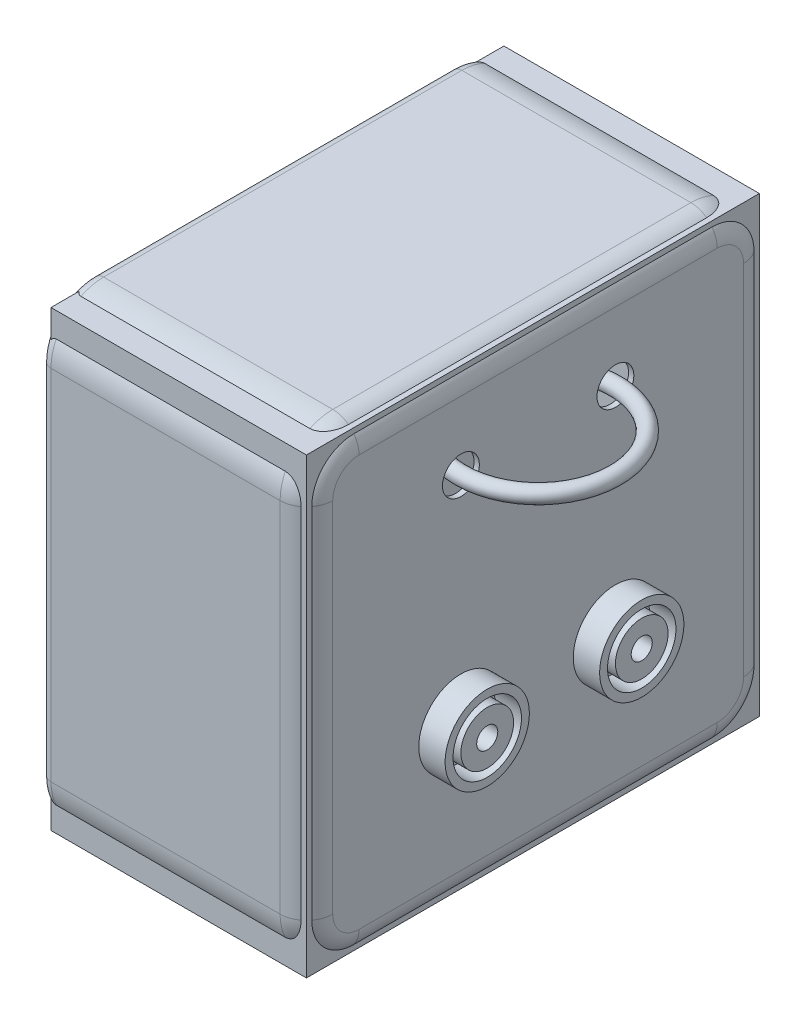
SolidWorks part; units mm, degrees
ref_plane "Plan de face" through (0, 0, 0) normal (0, 0, 1) x (1, 0, 0)
ref_plane "Plan de dessus" through (0, 0, 0) normal (0, 1, 0) x (1, 0, 0)
ref_plane "Plan de droite" through (0, 0, 0) normal (1, 0, 0) x (0, 0, -1)
sketch "Esquisse1" plane through (0, 0, 0) normal (1, 0, 0) x (0, 0, -1)
  line L1 (-44, 44) -> (44, 44)
  line L2 (-44, 44) -> (-44, -44)
  line L3 (-44, -44) -> (44, -44)
  line L4 (44, 44) -> (44, -44)
  line L5 (-44, 44) -> (44, -44) construction
  line L6 (-44, -44) -> (44, 44) construction
  point P0 (0, 0)
  dimension "D1" = 88
extrude "Boss.-Extru.1" add sketch "Esquisse1" along normal mid plane 50.5
sketch "Esquisse2" plane through (0, 0, 0) normal (1, 0, 0) x (0, 0, -1)
  line L0 (-44, 44) -> (-44, -44) construction
  line L1 (-43, 43) -> (43, 43)
  line L2 (-43, 43) -> (-43, -43)
  line L3 (-43, -43) -> (43, -43)
  line L4 (43, 43) -> (43, -43)
  line L5 (-43, 43) -> (43, -43) construction
  line L6 (-43, -43) -> (43, 43) construction
  point P0 (0, 0)
  dimension "D1" = 1
extrude "Enlèv. mat.-Extru.1" cut sketch "Esquisse2" against normal mid plane 48.5
fillet "Congé1" radius 10 4 edges at (0, 44, 44) (0, -44, 44) (0, 44, -44) (0, -44, -44)
fillet "Congé2" radius 5 8 edges at (25.25, 41.0711, 41.0711) (25.25, 44, 0) (25.25, 41.0711, -41.0711) (25.25, 0, -44) (25.25, -41.0711, -41.0711) (25.25, -44, 0) (25.25, -41.0711, 41.0711) (25.25, 0, 44)
fillet "Congé3" radius 2 8 edges at (-25.25, 41.0711, 41.0711) (-25.25, 44, 0) (-25.25, 41.0711, -41.0711) (-25.25, 0, -44) (-25.25, -41.0711, -41.0711) (-25.25, -44, 0) (-25.25, -41.0711, 41.0711) (-25.25, 0, 44)
sketch "Esquisse3" plane through (25.25, 0, 0) normal (1, 0, 0) x (0, 0, -1)
  line L0 (0, 0) -> (0, -14.6667) construction
  line L2 (0, -14.6667) -> (0, -29.3333) construction
  line L3 (0, -29.3333) -> (0, -44) construction
  line L4 (34, -44) -> (-34, -44) construction
  line L5 (0, -14.6667) -> (-14.6667, -14.6667) construction
  line L6 (-14.6667, -14.6667) -> (-29.3333, -14.6667) construction
  line L7 (-29.3333, -14.6667) -> (-44, -14.6667) construction
  line L8 (-44, -34) -> (-44, 34) construction
  circle A0 centre (-14.6667, -14.6667) radius 8
  dimension "D1" = 16
extrude "Boss.-Extru.2" add sketch "Esquisse3" along normal blind 5
sketch "Esquisse4" plane through (25.25, 0, 0) normal (1, 0, 0) x (0, 0, -1)
  line L0 (-14.6667, 0) -> (-14.6667, -6.6667) construction
  line L2 (-14.6667, 39) -> (-14.6667, 26) construction
  line L3 (34, 39) -> (-34, 39) construction
  line L4 (-14.6667, 26) -> (-14.6667, 13) construction
  line L6 (-14.6667, 13) -> (-14.6667, 0) construction
  line L7 (-14.6667, 0) -> (0, 0) construction
  circle A0 centre (-14.6667, 26) radius 3.5
  circle A2 centre (-14.6667, -14.6667) radius 8 construction
  dimension "D1" = 7
extrude "Enlèv. mat.-Extru.2" cut sketch "Esquisse4" against normal up to next
sketch "Esquisse5" plane through (30.25, 0, 0) normal (1, 0, 0) x (0, 0, -1)
  line L0 (-6.6667, -14.6667) -> (-8.1667, -14.6667) construction
  line L1 (-8.1667, -14.6667) -> (-9.6667, -14.6667) construction
  circle A0 centre (-14.6667, -14.6667) radius 6.5
  circle A1 centre (-14.6667, -14.6667) radius 5
  circle A3 centre (-14.6667, -14.6667) radius 8 construction
  circle A4 centre (-14.6667, -14.6667) radius 8 construction
  dimension "D1" = 1.5
extrude "Enlèv. mat.-Extru.3" cut sketch "Esquisse5" against normal up to surface (5 mm away)
sketch "Esquisse6" plane through (30.25, 0, 0) normal (1, 0, 0) x (0, 0, -1)
  circle A0 centre (-14.6667, -14.6667) radius 2
  circle A1 centre (-14.6667, -14.6667) radius 5 construction
  dimension "D1" = 4
extrude "Enlèv. mat.-Extru.4" cut sketch "Esquisse6" against normal up to surface (5 mm away)
mirror "Symétrie1" about plane through (0, 0, 0) normal (0, 0, 1) of "Enlèv. mat.-Extru.4", "Enlèv. mat.-Extru.3", "Enlèv. mat.-Extru.2", "Boss.-Extru.2"
ref_point "Point1"
ref_plane "Plan1" through (0, 26, 0) normal (0, 1, 0) x (1, 0, 0)
sketch "Esquisse7" plane through (0, 26, 0) normal (0, 1, 0) x (1, 0, 0)
  line L1 (25.25, 0) -> (0, 0) construction
  line L2 (25.25, 34) -> (25.25, -34) construction
  circle A0 centre (25.25, 0) radius 14.6667
sketch "Esquisse8" plane through (25.25, 0, 0) normal (1, 0, 0) x (0, 0, -1)
  circle A0 centre (-14.6667, 26) radius 1.5
  dimension "D1" = 3
sweep "Balayage1" add profiles "Esquisse8" path "Esquisse7"
sketch "Esquisse9" plane through (-25.25, 0, 0) normal (-1, 0, 0) x (0, 0, 1)
  line L0 (-29, 42) -> (-29, 27) construction
  line L1 (34, 42) -> (-34, 42) construction
  line L2 (-29, 27) -> (29, 27) construction
  line L3 (29, 27) -> (29, -27) construction
  line L4 (29, -27) -> (-29, -27) construction
  line L5 (-29, 27) -> (-44, 27) construction
  line L6 (-44, -34) -> (-44, 34) construction
  circle A0 centre (-29, 27) radius 1.585
  circle A1 centre (29, 27) radius 1.585
  circle A2 centre (29, -27) radius 1.585
  circle A3 centre (-29, -27) radius 1.585
  point P7 (29, 0)
  point P9 (0, 27)
  dimension "D2" = 3.17
  dimension "D1" = 15
extrude "Enlèv. mat.-Extru.5" cut sketch "Esquisse9" against normal up to next
